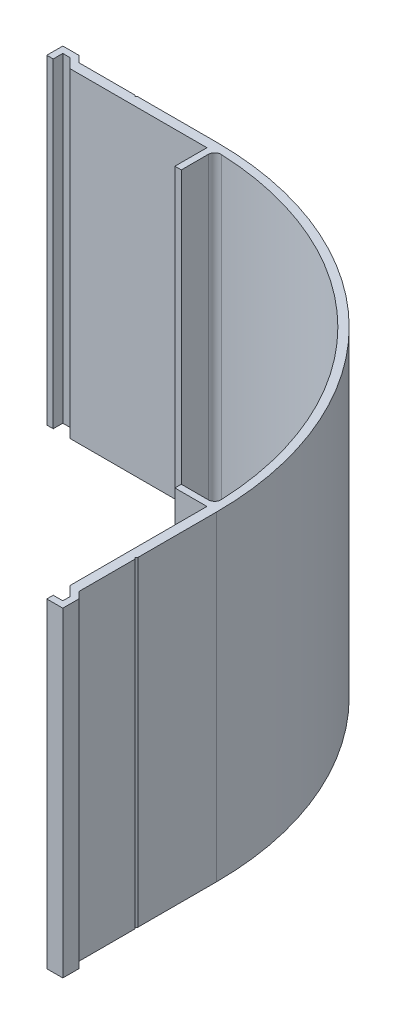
SolidWorks part; units mm, degrees
ref_plane "Front Plane" through (0, 0, 0) normal (0, 0, 1) x (1, 0, 0)
ref_plane "Top Plane" through (0, 0, 0) normal (0, 1, 0) x (1, 0, 0)
ref_plane "Right Plane" through (0, 0, 0) normal (1, 0, 0) x (0, 0, -1)
sketch "Sketch1" plane through (0, 0, 0) normal (0, 1, 0) x (1, 0, 0)
  line L0 (3, 50) -> (3, 25.4)
  line L1 (3, 7) -> (5, 5)
  line L2 (5, 5) -> (5, 0)
  line L3 (5, 0) -> (0, 0)
  line L4 (-1.5838, 52) -> (-10, 52)
  line L5 (-10, 52) -> (-10, 50)
  line L6 (-10, 50) -> (0, 50)
  line L7 (0, 50) -> (0, 7.1716)
  line L8 (0, 7.1716) -> (3, 4.1716)
  line L9 (3, 4.1716) -> (3, 2)
  line L10 (3, 2) -> (0, 2)
  line L11 (0, 2) -> (0, 0)
  line L12 (3, 24.6) -> (2.6, 25)
  line L13 (3, 24.6) -> (3, 7)
  line L14 (2.6, 25) -> (3, 25.4)
  line L15 (-121.6, 150) -> (-97, 150)
  line L16 (-142, 152) -> (-140, 150)
  line L17 (-147, 152) -> (-142, 152)
  line L18 (-147, 147) -> (-147, 152)
  line L19 (-95, 137) -> (-95, 145.4162)
  line L20 (-97, 137) -> (-95, 137)
  line L21 (-97, 147) -> (-97, 137)
  line L22 (-139.8284, 147) -> (-97, 147)
  line L23 (-142.8284, 150) -> (-139.8284, 147)
  line L24 (-145, 150) -> (-142.8284, 150)
  line L25 (-145, 147) -> (-145, 150)
  line L26 (-147, 147) -> (-145, 147)
  line L27 (-122, 149.6) -> (-122.4, 150)
  line L28 (-140, 150) -> (-122.4, 150)
  line L29 (-121.6, 150) -> (-122, 149.6)
  arc A0 (3, 50) -> (-97, 150) centre (-97, 50) ccw
  arc A1 (0.4144, 54.0838) -> (-92.9162, 147.4144) centre (-97, 50) ccw
  arc A2 (-1.5838, 52) -> (0.4144, 54.0838) centre (-1.5838, 54) ccw
  arc A3 (-92.9162, 147.4144) -> (-95, 145.4162) centre (-93, 145.4162) ccw
extrude "Extrude1" add sketch "Sketch1" along normal mid plane 100
